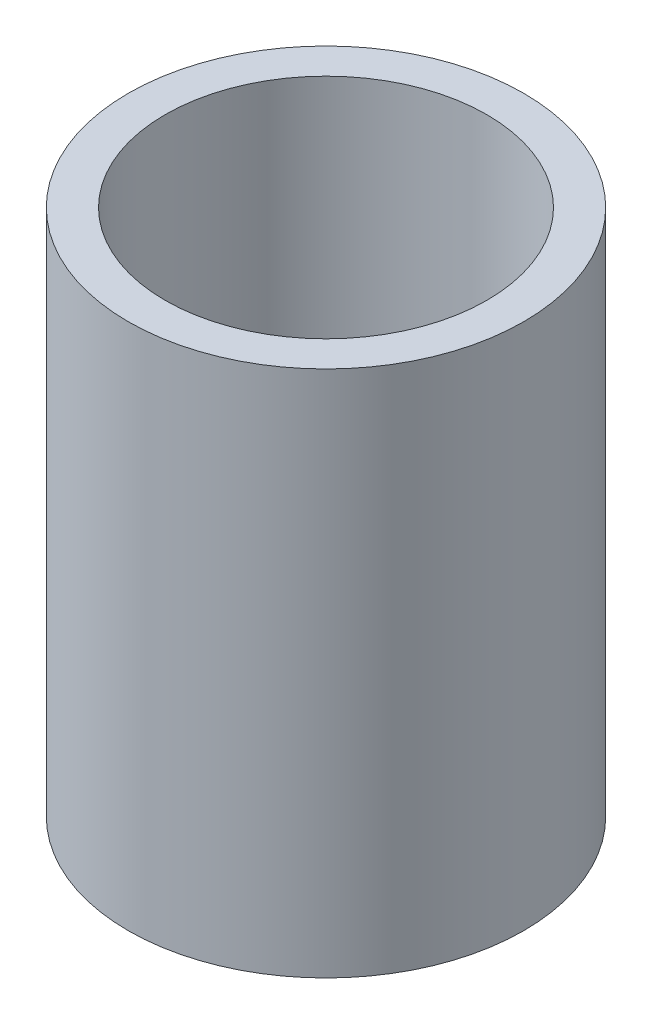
SolidWorks part; units mm, degrees
ref_plane "Front Plane" through (0, 0, 0) normal (0, 0, 1) x (1, 0, 0)
ref_plane "Top Plane" through (0, 0, 0) normal (0, 1, 0) x (1, 0, 0)
ref_plane "Right Plane" through (0, 0, 0) normal (1, 0, 0) x (0, 0, -1)
sketch "Sketch1" plane through (0, 0, 0) normal (0, 1, 0) x (1, 0, 0)
  circle A0 centre (0, 0) radius 4.7625
  circle A1 centre (0, 0) radius 3.8735
  dimension "D1" = 0.889
  dimension "D2" = 9.525
extrude "Boss-Extrude1" add sketch "Sketch1" against normal up to surface (12.7 mm away)
